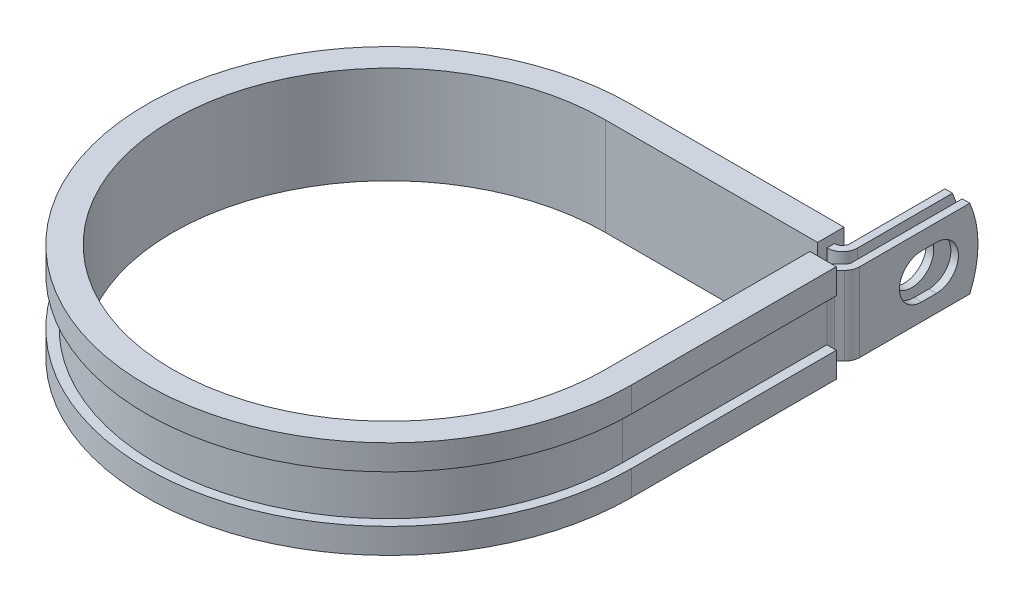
SolidWorks part; units mm, degrees
ref_plane "Front Plane" through (0, 0, 0) normal (0, 0, 1) x (1, 0, 0)
ref_plane "Top Plane" through (0, 0, 0) normal (0, 1, 0) x (1, 0, 0)
ref_plane "Right Plane" through (0, 0, 0) normal (1, 0, 0) x (0, 0, -1)
sketch "Sketch1" plane through (0, 0, 0) normal (0, 1, 0) x (1, 0, 0)
  line L0 (0, 36.449) -> (34.3333, 36.449)
  line L1 (36.449, 0) -> (36.449, 33.0365)
  line L2 (36.7717, 55.5498) -> (36.7717, 38.8874)
  line L3 (37.1632, 34.7607) -> (37.9894, 35.5869)
  line L5 (38.3465, 36.449) -> (38.3465, 55.5498)
  arc A0 (0, 36.449) -> (36.449, 0) centre (0, 0) ccw
  arc A1 (37.1632, 34.7607) -> (36.449, 33.0365) centre (38.8874, 33.0365) ccw
  arc A2 (37.9894, 35.5869) -> (38.3465, 36.449) centre (37.1273, 36.449) ccw
  arc A3 (34.3333, 36.449) -> (36.7717, 38.8874) centre (34.3333, 38.8874) ccw
extrude "Extrude-Thin1" add sketch "Sketch1" along normal mid plane 12.7 thin
sketch "Sketch2" plane through (35.5525, 0, 0) normal (-1, 0, 0) x (0, 0, 1)
  line L0 (-55.5498, 6.35) -> (-55.5498, -6.35) construction
  line L1 (0, 6.35) -> (0, -6.35) construction
  circle A0 centre (-47.625, 0) radius 3.5687
  point P2 (-55.5498, 0)
extrude "Cut-Extrude1" cut sketch "Sketch2" against normal up to surface (1.2192 mm away)
sketch "Sketch3" plane through (39.5657, 0, 0) normal (1, 0, 0) x (0, 0, -1)
  line L0 (46.4312, 0) -> (48.8188, 0) construction
  line L1 (46.4312, 3.5687) -> (48.8188, 3.5687)
  line L2 (46.4312, -3.5687) -> (48.8188, -3.5687)
  line L3 (55.5498, 6.35) -> (55.5498, -6.35) construction
  arc A0 (46.4312, 3.5687) -> (46.4312, -3.5687) centre (46.4312, 0) ccw
  arc A1 (48.8188, -3.5687) -> (48.8188, 3.5687) centre (48.8188, 0) ccw
  point P3 (47.625, 0)
  point P8 (55.5498, 0)
  point P11 (42.8625, 0)
  point P12 (52.3875, 0)
extrude "Cut-Extrude2" cut sketch "Sketch3" against normal up to surface (1.2192 mm away)
sketch "Sketch4" plane through (35.5525, 0, 0) normal (-1, 0, 0) x (0, 0, 1)
  line L0 (-55.5498, 6.35) -> (-55.5498, -6.35)
  line L1 (-55.5498, 6.35) -> (-54.2245, 6.35)
  line L2 (-55.5498, 6.35) -> (-38.8874, 6.35) construction
  line L3 (-55.5498, -6.35) -> (-54.2245, -6.35)
  line L4 (-55.5498, -6.35) -> (-38.8874, -6.35) construction
  arc A0 (-54.2245, 6.35) -> (-54.2245, -6.35) centre (-39.6748, 0) ccw
extrude "Cut-Extrude3" cut sketch "Sketch4" against normal through all contours A0 M4 M5 | A0 L0 M2
ref_plane "Plane1" through (0, 0, -33.0365) normal (0, 0, -1) x (-1, 0, 0)
ref_plane "Plane2" through (34.2825, 0, 0) normal (-1, 0, 0) x (0, 0, 1)
sketch "Sketch5" plane through (0, 0, -33.0365) normal (0, 0, -1) x (-1, 0, 0)
  line L0 (-37.6682, 6.35) -> (-36.449, 6.35)
  line L1 (-37.6682, 6.35) -> (-37.6682, -6.35) construction
  line L3 (-36.449, 6.35) -> (-36.449, -6.35)
  line L4 (-36.449, -6.35) -> (-37.6682, -6.35)
  line L5 (-37.6682, -6.35) -> (-37.6682, -3.81)
  line L6 (-37.6682, 6.35) -> (-37.6682, 3.81)
  line L7 (-39.1922, 7.874) -> (-39.1922, 3.81)
  line L8 (-39.1922, 7.874) -> (-34.925, 7.874)
  line L9 (-34.925, 7.874) -> (-34.925, -7.874)
  line L10 (-34.925, -7.874) -> (-39.1922, -7.874)
  line L11 (-39.1922, -7.874) -> (-39.1922, -3.81)
  line L12 (-39.1922, 3.81) -> (-37.6682, 3.81)
  line L13 (-37.6682, -3.81) -> (-39.1922, -3.81)
sketch "Sketch6" plane through (0, 6.35, 0) normal (0, 1, 0) x (1, 0, 0)
  line L0 (34.925, 0) -> (34.925, 33.0365)
  line L1 (34.925, 33.0365) -> (39.1922, 33.0365) construction
  line L2 (34.2825, 6.9878) -> (34.2825, -6.9878) construction
  line L5 (0, 34.925) -> (34.2825, 34.925)
  arc A0 (0, 34.925) -> (34.925, 0) centre (0, 0) ccw
sweep "Sweep1" add profiles "Sketch5" path "Sketch6"
equation "\"D4@Sketch5\" = \"D1@Extrude-Thin1\""
equation "\"D5@Sketch5\" = \"D5@Extrude-Thin1\""
equation "\"D1@Sketch3\" = \"D2@Sketch2\""
equation "\"D7@Sketch1\" = \"D3@Sketch2\" + \"D1@Sketch3\""
equation "\"D1@Sketch1\" = \"D1@Sketch6\" + 2 * \"D3@Sketch5\""
equation "\"D1@Sketch4\" = ( \"D1@Extrude-Thin1\" + .125 ) * 2"
equation "\"D9@Sketch1\"= \"D5@Extrude-Thin1\""
equation "\"D8@Sketch1\"= 2 * \"D5@Extrude-Thin1\""
equation "\"D2@Sketch1\" = 2 * \"D5@Extrude-Thin1\""
equation "\"D2@Sketch3\" = \"D1@Sketch2\""
